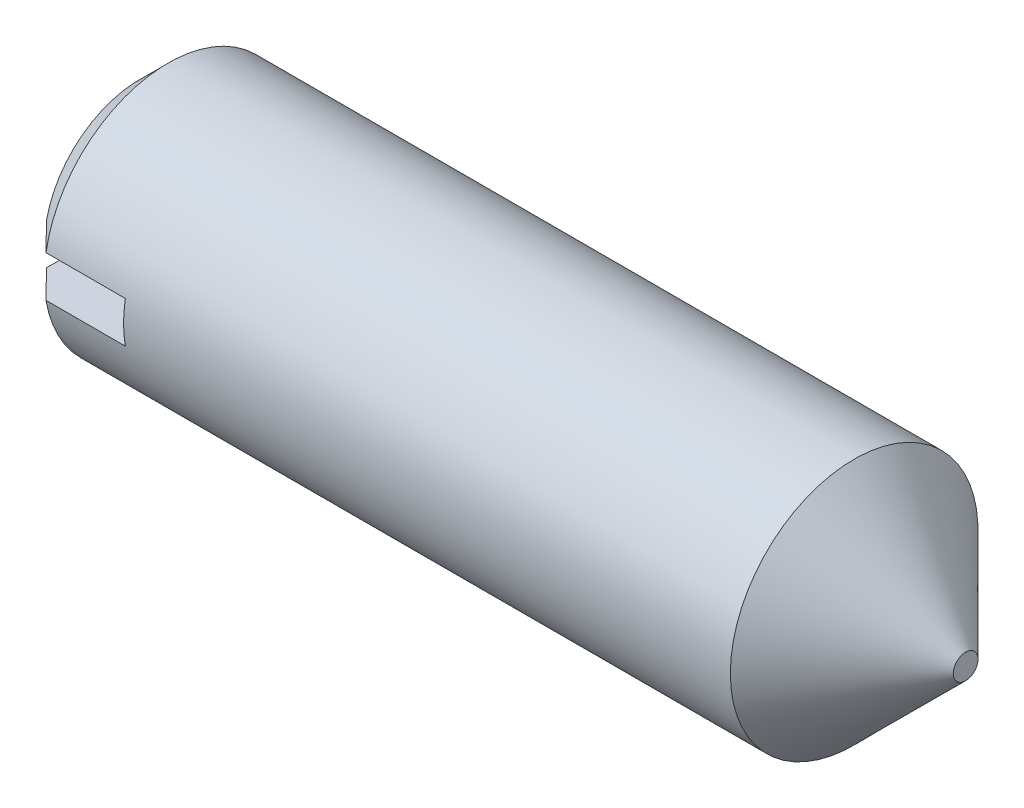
SolidWorks part; units mm, degrees
ref_plane "Front" through (0, 0, 0) normal (0, 0, 1) x (1, 0, 0)
ref_plane "Top" through (0, 0, 0) normal (0, 1, 0) x (1, 0, 0)
ref_plane "Right" through (0, 0, 0) normal (1, 0, 0) x (0, 0, -1)
sketch "Sketch1" plane through (0, 0, 0) normal (0, 0, 1) x (1, 0, 0)
  line L0 (0, 0) -> (4, 0)
  line L1 (4, 0) -> (4, 0.06)
  line L2 (4, 0.06) -> (3.46, 0.6)
  line L3 (3.46, 0.6) -> (0.1355, 0.6)
  line L4 (0.1355, 0.6) -> (0, 0.4645)
  line L5 (0, 0.4645) -> (0, 0)
  line L6 (-14.7741, 0) -> (12.5137, 0) construction
  dimension "D1" = 45
  dimension "l" = 4
  dimension "D2" = 45
  dimension "dt" = 0.12
  dimension "d" = 1.2
  dimension "df" = 0.929
revolve "Base" add sketch "Sketch1" angle 360 about L6
sketch "Sketch2" plane through (0, 0, 0) normal (0, 0, 1) x (1, 0, 0)
  line L1 (0, 0.1) -> (0.52, 0.1)
  line L2 (0, 0.1) -> (0, -0.1)
  line L3 (0, -0.1) -> (0.52, -0.1)
  line L4 (0.52, 0.1) -> (0.52, -0.1)
  line L5 (0, 0.4645) -> (0, -0.4645) construction
  dimension "m" = 0.1
  dimension "n" = 0.2
  dimension "t" = 0.52
extrude "Notch" cut sketch "Sketch2" against normal through all and the other way through all
sketch "Sketch3" plane through (0, 0, 0) normal (0, 0, 1) x (1, 0, 0)
  line L0 (0.1355, 0.4827) -> (0.2033, 0.6)
  line L1 (0.2033, 0.6) -> (0.2033, 0.7355)
  line L2 (0.2033, 0.7355) -> (0.0678, 0.7355)
  line L3 (0.0678, 0.7355) -> (0.0678, 0.6)
  line L4 (0.0678, 0.6) -> (0.1355, 0.4827)
  line L5 (0, 0) -> (2.4208, 0) construction
  line L6 (0.1355, 0.6) -> (0.1355, 0.1) construction
  dimension "D1" = 1.2
  dimension "D2" = 0.1355
revolve "Cut-Revolve10" [suppressed] cut sketch "Sketch3" angle 360 about L5
pattern_linear "LPattern10" [suppressed] count 24 spacing 0.1626 along (1, 0, 0)
equation "\"df@Sketch1\" = \"D2@ThreadCosmetic1\""
equation "\"m@Sketch2\" = \"n@Sketch2\" / 2"
equation "\"D1@Sketch3\" = \"d@Sketch1\""
equation "\"D2@Sketch3\" =  ( \"d@Sketch1\" - \"D2@ThreadCosmetic1\" )  / 2"
equation "\"D3@LPattern10\" = \"D2@Sketch3\" * 1.2"
equation "\"D1@LPattern10\" =  ( \"l@Sketch1\" -  ( \"d@Sketch1\" - \"df@Sketch1\" )  / 2 )  / \"D3@LPattern10\""
